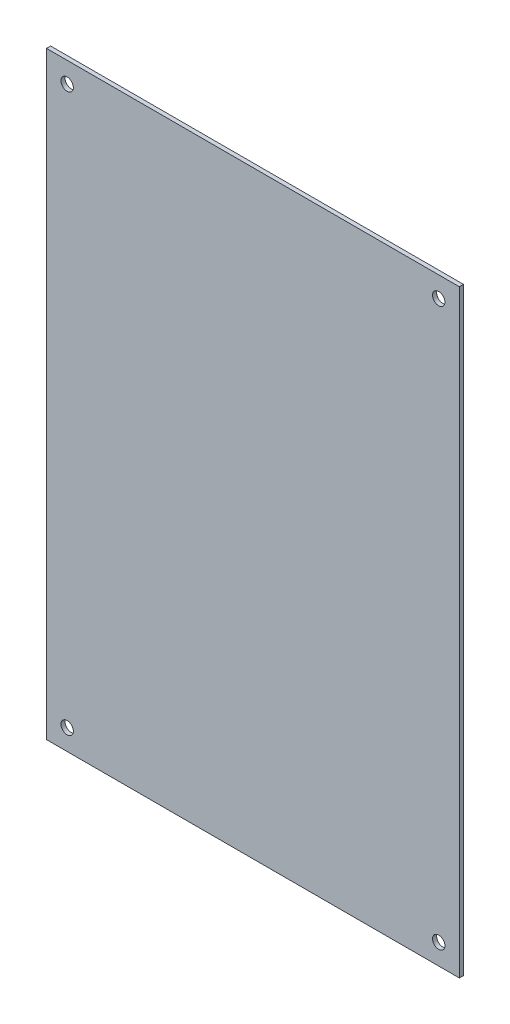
SolidWorks part; units mm, degrees
ref_plane "Plan de face" through (0, 0, 0) normal (0, 0, 1) x (1, 0, 0)
ref_plane "Plan de dessus" through (0, 0, 0) normal (0, 1, 0) x (1, 0, 0)
ref_plane "Plan de droite" through (0, 0, 0) normal (1, 0, 0) x (0, 0, -1)
sketch "Esquisse1" plane through (0, 0, 0) normal (0, 0, 1) x (1, 0, 0)
  line L1 (-50, 0) -> (50, 0)
  line L2 (-50, 0) -> (-50, -145)
  line L3 (-50, -145) -> (50, -145)
  line L4 (50, 0) -> (50, -145)
  dimension "D1" = 100
  dimension "D2" = 145
extrude "Extrusion1" add sketch "Esquisse1" along normal blind 1
hole_wizard "Diamètre du perçage M3.0 (3.000000)1" positions "Esquisse3" profile "Esquisse2" hole size "M3.0" standard "ISO"
sketch "Esquisse3" plane through (0, 0, 1) normal (0, 0, 1) x (1, 0, 0)
  line L0 (-50, 0) -> (-50, -145) construction
  line L1 (50, 0) -> (-50, 0) construction
  line L2 (50, -145) -> (50, 0) construction
  line L3 (-50, -145) -> (50, -145) construction
  point P0 (-45, -5)
  point P1 (45, -5)
  point P2 (-45, -140)
  point P3 (45, -140)
  dimension "D1" = 5
  dimension "D2" = 5
  dimension "D3" = 5
  dimension "D4" = 5
sketch "Esquisse2" plane through (-45, -5, 1) normal (1, 0, 0) x (0, -1, 0)
  line L0 (0, 0) -> (0, 1)
  line L1 (0, 1) -> (1.5, 1)
  line L2 (1.5, 1) -> (1.5, 0)
  line L5 (1.5, 0) -> (0, 0)
  line L11 (0, -6.35) -> (0, 107.95) construction
  dimension "Diamètre du perçage jusqu'au prochain" = 3
  dimension "Profondeur du perçage jusqu'au prochain" = 1
